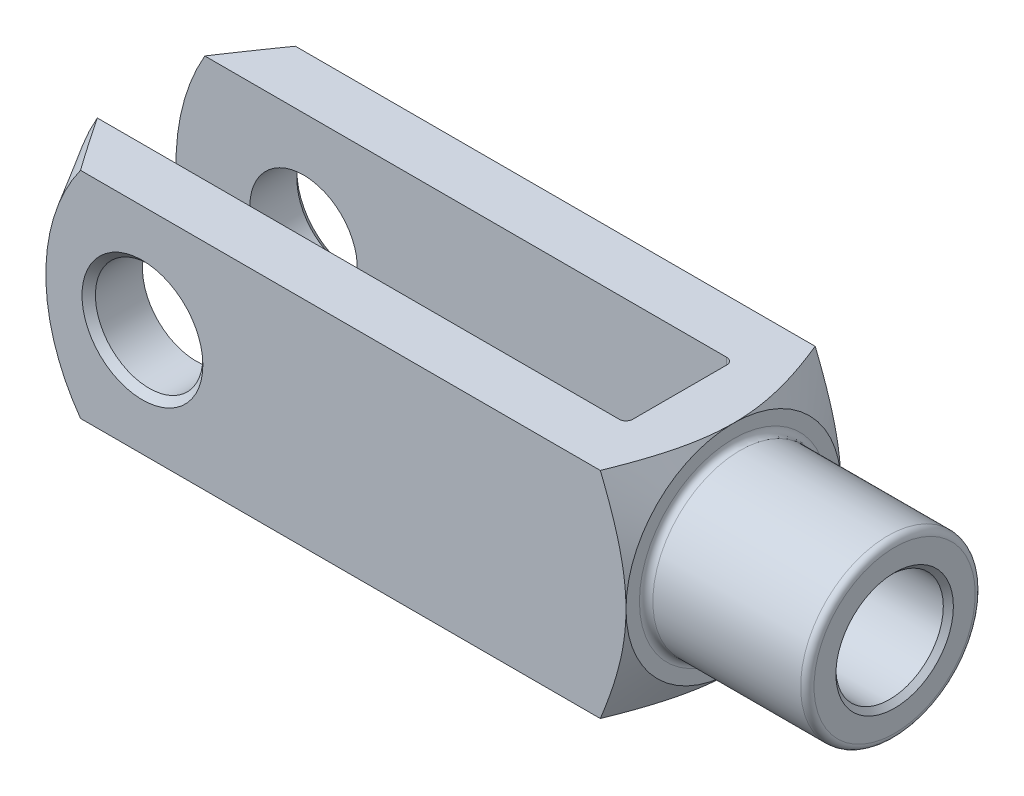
SolidWorks part; units mm, degrees
ref_plane "Front Plane" through (0, 0, 0) normal (0, 0, 1) x (1, 0, 0)
ref_plane "Top Plane" through (0, 0, 0) normal (0, 1, 0) x (1, 0, 0)
ref_plane "Right Plane" through (0, 0, 0) normal (1, 0, 0) x (0, 0, -1)
sketch "Sketch1" plane through (0, 0, 0) normal (1, 0, 0) x (0, 0, -1)
  line L0 (0, 0) -> (0, 50000) construction
  line L1 (0, 0) -> (50000, 0) construction
  line L2 (-16, -16) -> (-16, 16)
  line L3 (-16, 16) -> (16, 16)
  line L4 (16, -16) -> (16, 16)
  line L5 (-16, -16) -> (16, -16)
  point P9 (0, 16)
  point P11 (16, 0)
  point P12 (-16, 0)
  dimension "D1" = 32
  dimension "D2" = 32
extrude "Extrude1" add sketch "Sketch1" against normal blind 115
sketch "Sketch2" plane through (0, 0, 0) normal (1, 0, 0) x (0, 0, -1)
  circle A0 centre (0, 0) radius 13
  circle A1 centre (0, 0) radius 26
  dimension "D1" = 26
  dimension "D2" = 52
extrude "Extrude2" cut sketch "Sketch2" against normal blind 24
sketch "Sketch3" plane through (0, 0, 16) normal (0, 0, 1) x (1, 0, 0)
  circle A0 centre (-96, 0) radius 8
  dimension "D1" = 16
  dimension "D2" = 96
extrude "Extrude3" cut sketch "Sketch3" against normal through all
sketch "Sketch4" plane through (0, 16, 0) normal (0, 1, 0) x (1, 0, 0)
  line L0 (0, 0) -> (-50000, 0) construction
  line L1 (-115, -8) -> (-115, 8)
  line L2 (-115, 16) -> (-115, -16) construction
  line L3 (-115, 8) -> (-32, 8)
  line L4 (-32, 8) -> (-32, -8)
  line L5 (-96, 16) -> (-96, -16) construction
  line L6 (-115, -8) -> (-32, -8)
  point P7 (-96, 0)
  point P13 (-32, 0)
  point P14 (-115, 0)
  dimension "D1" = 64
  dimension "D2" = 16
extrude "Extrude4" cut sketch "Sketch4" against normal through all
fillet "Fillet1" radius 1 2 edges at (-32, 0, 8) (-32, 0, -8)
fillet "Fillet2" radius 1 2 edges at (0, 0, -13) (-24, 0, -13)
chamfer "Chamfer2" distance 1 angle 45 2 edges at (-88, 0, -16) (-88, 0, 16)
sketch "Sketch6" plane through (0, 0, 0) normal (0, 0, 1) x (1, 0, 0)
  line L0 (-24, -16) -> (-24, -32)
  line L1 (-24, -32) -> (-33.2376, -32)
  line L2 (-33.2376, -32) -> (-24, -16)
  dimension "D1" = 30
  dimension "D2" = 32
revolve "Cut-Revolve1" cut sketch "Sketch6" angle 360 about axis through (-24, 0, 0) along (1, 0, 0)
sketch "Sketch7" plane through (0, 0, 0) normal (0, 1, 0) x (1, 0, 0)
  line L0 (-110.3812, -16) -> (-115, -8)
  line L1 (-115, 8) -> (-110.3812, 16)
  line L2 (-110.3812, 16) -> (-147, 16)
  line L3 (-115, 8) -> (-115, -8)
  line L4 (-147, 16) -> (-147, -16)
  line L5 (-147, -16) -> (-110.3812, -16)
  line L6 (-115, 16) -> (-27.8263, 16) construction
  line L7 (-115, -16) -> (-27.8263, -16) construction
  line L8 (-83, 0.6162) -> (-83, 50000.6162) construction
  dimension "D1" = 120
  dimension "D2" = 32
  dimension "D3" = 32
revolve "Cut-Revolve2" cut sketch "Sketch7" angle 180 about L8
sketch "Sketch8" plane through (0, 0, 0) normal (1, 0, 0) x (0, 0, -1)
  circle A0 centre (0, 0) radius 8
  dimension "D1" = 16
extrude "Extrude5" cut sketch "Sketch8" against normal through all
chamfer "Chamfer3" distance 0.75 angle 45 1 edges at (0, 0, -8)
equation "\"D2@Sketch1\" = \"D1@Sketch1\""
equation "\"D2@Sketch2\" = \"D1@Sketch2\"*2"
equation "\"D2@Sketch6\" = \"D1@Sketch1\""
equation "\"D2@Sketch7\" = \"D1@Sketch1\""
equation "\"D3@Sketch7\" = \"D1@Sketch1\""
